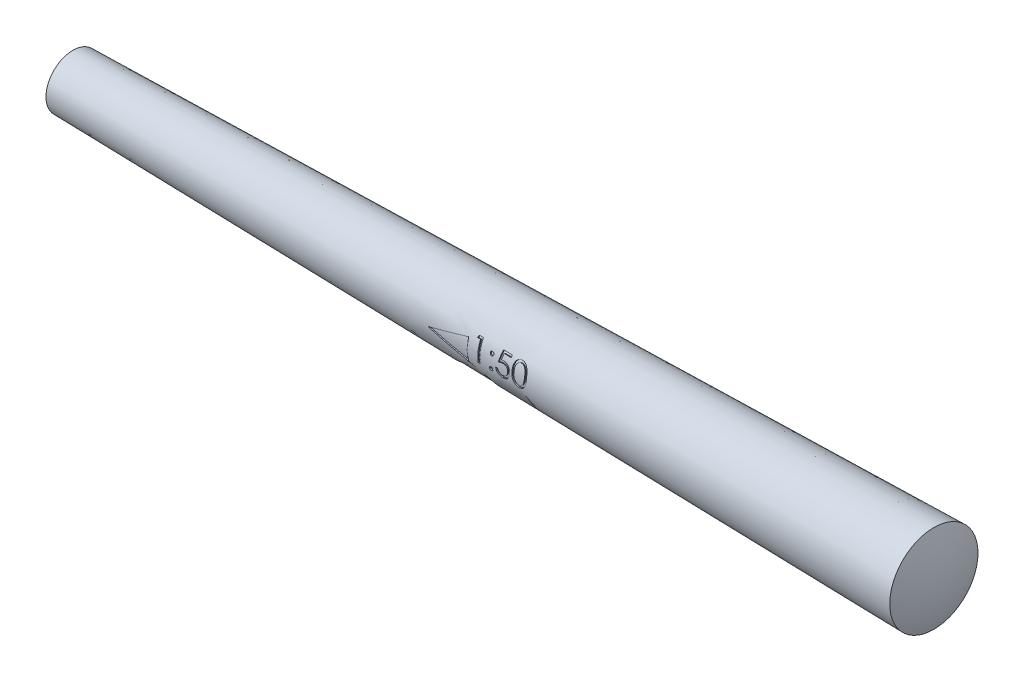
SolidWorks part; units mm, degrees
ref_plane "Front Plane" through (0, 0, 0) normal (0, 0, 1) x (1, 0, 0)
ref_plane "Top Plane" through (0, 0, 0) normal (0, 1, 0) x (1, 0, 0)
ref_plane "Right Plane" through (0, 0, 0) normal (1, 0, 0) x (0, 0, -1)
sketch "Sketch1" plane through (0, 0, 0) normal (1, 0, 0) x (0, 0, -1)
  circle A0 centre (0, 0) radius 1.25
  dimension "D1" = 2.5
extrude "Extrude1" add sketch "Sketch1" along normal mid plane 40
draft "Draft1" type of draft neutral plane draft angle 1.146 faces to draft 1 parameters "D1"=1.146
sketch "Sketch2" plane through (0, 0, 0) normal (0, 0, 1) x (1, 0, 0)
  line L0 (-20, 0) -> (-20, 1.25)
  line L1 (-20, 1.25) -> (-20, -1.25) construction
  line L2 (-20, 0) -> (-20.4, 0)
  line L3 (-20.4, 0) -> (-20.4, -1.65) construction
  line L4 (20, 0) -> (20, 2.05)
  line L5 (20, -2.05) -> (20, 2.05) construction
  line L6 (20, 0) -> (20.4, 0)
  line L7 (20.4, 0) -> (20.4, -1.65) construction
  line L8 (-20, -1.25) -> (20, -2.05) construction
  arc A0 (-20.4, 0) -> (-20, 1.25) centre (-18.2469, 0) cw
  arc A1 (20.4, 0) -> (20, 2.05) centre (14.9467, 0) ccw
  point P14 (0, -1.65)
revolve "Revolve1" add sketch "Sketch2" angle 360 about L2
sketch "Sketch5" plane through (0, 0, 0) normal (0, 0, 1) x (1, 0, 0)
  line L0 (0, 1.65) -> (0, -1.65) construction
  line L1 (20, 2.05) -> (-20, 1.25) construction
  line L2 (-20, -1.25) -> (20, -2.05) construction
ref_plane "Plane2" through (0, 0, 0) normal (-0.02, 0, 0.9998) x (0.9998, 0, 0.02)
sketch "Sketch6" plane through (0, 0, 0) normal (-0.02, 0, 0.9998) x (0.9998, 0, 0.02)
  line L0 (0, 0) -> (0, 0.5)
  line L1 (0, 1.65) -> (0, -1.65) construction
  line L2 (0, 0.5) -> (-1.866, 0)
  line L3 (-1.866, 0) -> (0, -0.5)
  line L4 (0, -0.5) -> (0, 0)
  line L5 (0, -0.25) -> (3, -0.25) construction
  text T0 "1:50" font "Century Gothic" height 1
  dimension "D1" = 1
  dimension "D2" = 30
  dimension "D3" = 3
wrap "Wrap2" sketch "Sketch6" wrap type deboss source sketch "Sketch6" thickness 0.05 parameters "D1"=0.05
equation "\"D2@Sketch2\" = \"D1@Sketch2\""
